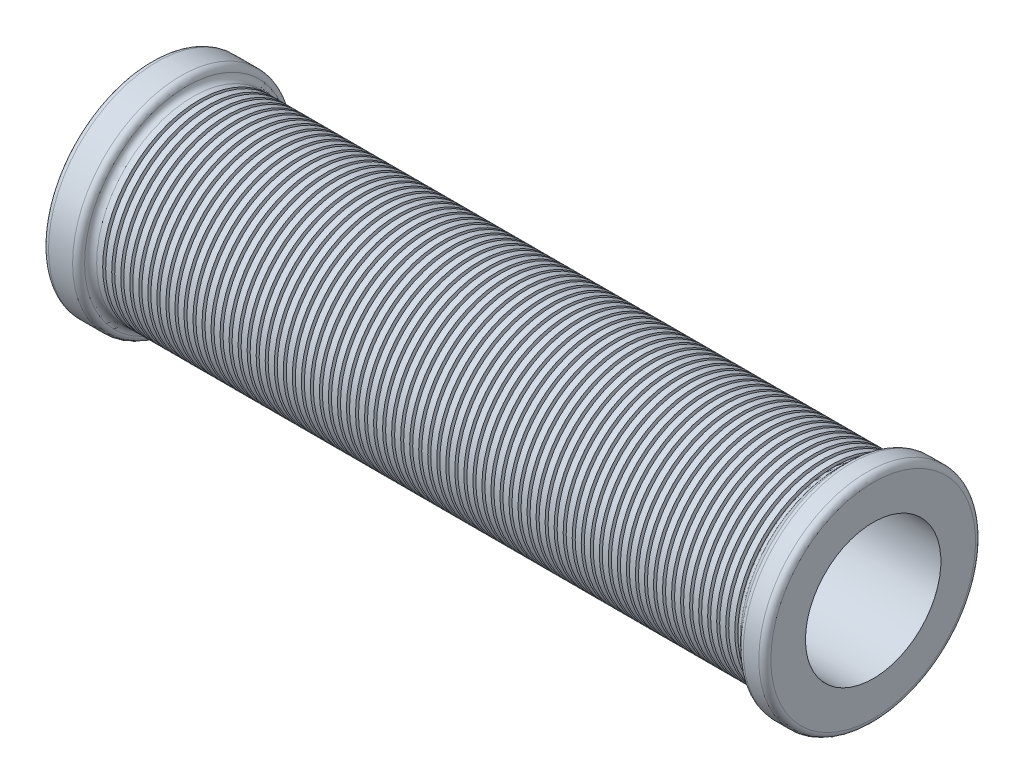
SolidWorks part; units mm, degrees
ref_plane "Alzado" through (0, 0, 0) normal (0, 0, 1) x (1, 0, 0)
ref_plane "Planta" through (0, 0, 0) normal (0, 1, 0) x (1, 0, 0)
ref_plane "Vista lateral" through (0, 0, 0) normal (1, 0, 0) x (0, 0, -1)
sketch "Croquis1" plane through (0, 0, 0) normal (0, 0, 1) x (1, 0, 0)
  line L0 (0, 0) -> (120, 0) construction
  line L1 (0, 0) -> (0, 11.25) construction
  line L2 (0, 18) -> (6, 18)
  line L3 (120, 11.25) -> (120, 0) construction
  line L4 (0, 11.25) -> (120, 11.25)
  line L5 (0, 11.25) -> (0, 18)
  line L7 (120, 11.25) -> (120, 18)
  line L8 (6, 18) -> (6, 16)
  line L9 (6, 16) -> (116, 16)
  line L10 (116, 16) -> (116, 18)
  line L11 (116, 18) -> (120, 18)
  point P12 (118, 18)
  dimension "D1" = 18
  dimension "D2" = 2
  dimension "D3" = 120
  dimension "D4" = 6
  dimension "D5" = 4
  dimension "D6" = 11.25
revolve "Revolución1" add sketch "Croquis1" angle 360 about L0
chamfer "Chaflán1" distance 2 angle 45 1 edges at (116, 0, 16)
fillet "Redondeo1" radius 1 6 edges at (120, 0, 18) (116, 0, 18) (114, 0, -16) (6, 0, 16) (6, 0, 18) (0, 0, 18)
sketch "Croquis2" plane through (0, 0, 0) normal (0, 0, 1) x (1, 0, 0)
  line L0 (113.5858, 16) -> (7, 16) construction
  line L1 (8, 16) -> (8.5, 16)
  line L2 (8, 16) -> (8, 15)
  line L3 (8, 15) -> (8.5, 15)
  line L4 (8.5, 16) -> (8.5, 15)
  line L5 (7, -16) -> (7, 16) construction
  line L6 (0, 0) -> (119, 0) construction
  line L7 (119, 18) -> (119, -18) construction
  line L372 (9.5, 16) -> (10, 16)
  line L373 (10, 16) -> (10, 15)
  line L374 (9.5, 15) -> (10, 15)
  line L375 (9.5, 16) -> (9.5, 15)
  line L376 (1.5, 0) -> (120.5, 0) construction
  line L377 (11, 16) -> (11.5, 16)
  line L378 (11.5, 16) -> (11.5, 15)
  line L379 (11, 15) -> (11.5, 15)
  line L380 (11, 16) -> (11, 15)
  line L381 (3, 0) -> (122, 0) construction
  line L382 (12.5, 16) -> (13, 16)
  line L383 (13, 16) -> (13, 15)
  line L384 (12.5, 15) -> (13, 15)
  line L385 (12.5, 16) -> (12.5, 15)
  line L386 (4.5, 0) -> (123.5, 0) construction
  line L387 (14, 16) -> (14.5, 16)
  line L388 (14.5, 16) -> (14.5, 15)
  line L389 (14, 15) -> (14.5, 15)
  line L390 (14, 16) -> (14, 15)
  line L391 (6, 0) -> (125, 0) construction
  line L392 (15.5, 16) -> (16, 16)
  line L393 (16, 16) -> (16, 15)
  line L394 (15.5, 15) -> (16, 15)
  line L395 (15.5, 16) -> (15.5, 15)
  line L396 (7.5, 0) -> (126.5, 0) construction
  line L397 (17, 16) -> (17.5, 16)
  line L398 (17.5, 16) -> (17.5, 15)
  line L399 (17, 15) -> (17.5, 15)
  line L400 (17, 16) -> (17, 15)
  line L401 (9, 0) -> (128, 0) construction
  line L402 (18.5, 16) -> (19, 16)
  line L403 (19, 16) -> (19, 15)
  line L404 (18.5, 15) -> (19, 15)
  line L405 (18.5, 16) -> (18.5, 15)
  line L406 (10.5, 0) -> (129.5, 0) construction
  line L407 (20, 16) -> (20.5, 16)
  line L408 (20.5, 16) -> (20.5, 15)
  line L409 (20, 15) -> (20.5, 15)
  line L410 (20, 16) -> (20, 15)
  line L411 (12, 0) -> (131, 0) construction
  line L412 (21.5, 16) -> (22, 16)
  line L413 (22, 16) -> (22, 15)
  line L414 (21.5, 15) -> (22, 15)
  line L415 (21.5, 16) -> (21.5, 15)
  line L416 (13.5, 0) -> (132.5, 0) construction
  line L417 (23, 16) -> (23.5, 16)
  line L418 (23.5, 16) -> (23.5, 15)
  line L419 (23, 15) -> (23.5, 15)
  line L420 (23, 16) -> (23, 15)
  line L421 (15, 0) -> (134, 0) construction
  line L422 (24.5, 16) -> (25, 16)
  line L423 (25, 16) -> (25, 15)
  line L424 (24.5, 15) -> (25, 15)
  line L425 (24.5, 16) -> (24.5, 15)
  line L426 (16.5, 0) -> (135.5, 0) construction
  line L427 (26, 16) -> (26.5, 16)
  line L428 (26.5, 16) -> (26.5, 15)
  line L429 (26, 15) -> (26.5, 15)
  line L430 (26, 16) -> (26, 15)
  line L431 (18, 0) -> (137, 0) construction
  line L432 (27.5, 16) -> (28, 16)
  line L433 (28, 16) -> (28, 15)
  line L434 (27.5, 15) -> (28, 15)
  line L435 (27.5, 16) -> (27.5, 15)
  line L436 (19.5, 0) -> (138.5, 0) construction
  line L437 (29, 16) -> (29.5, 16)
  line L438 (29.5, 16) -> (29.5, 15)
  line L439 (29, 15) -> (29.5, 15)
  line L440 (29, 16) -> (29, 15)
  line L441 (21, 0) -> (140, 0) construction
  line L442 (30.5, 16) -> (31, 16)
  line L443 (31, 16) -> (31, 15)
  line L444 (30.5, 15) -> (31, 15)
  line L445 (30.5, 16) -> (30.5, 15)
  line L446 (22.5, 0) -> (141.5, 0) construction
  line L447 (32, 16) -> (32.5, 16)
  line L448 (32.5, 16) -> (32.5, 15)
  line L449 (32, 15) -> (32.5, 15)
  line L450 (32, 16) -> (32, 15)
  line L451 (24, 0) -> (143, 0) construction
  line L452 (33.5, 16) -> (34, 16)
  line L453 (34, 16) -> (34, 15)
  line L454 (33.5, 15) -> (34, 15)
  line L455 (33.5, 16) -> (33.5, 15)
  line L456 (25.5, 0) -> (144.5, 0) construction
  line L457 (35, 16) -> (35.5, 16)
  line L458 (35.5, 16) -> (35.5, 15)
  line L459 (35, 15) -> (35.5, 15)
  line L460 (35, 16) -> (35, 15)
  line L461 (27, 0) -> (146, 0) construction
  line L462 (36.5, 16) -> (37, 16)
  line L463 (37, 16) -> (37, 15)
  line L464 (36.5, 15) -> (37, 15)
  line L465 (36.5, 16) -> (36.5, 15)
  line L466 (28.5, 0) -> (147.5, 0) construction
  line L467 (38, 16) -> (38.5, 16)
  line L468 (38.5, 16) -> (38.5, 15)
  line L469 (38, 15) -> (38.5, 15)
  line L470 (38, 16) -> (38, 15)
  line L471 (30, 0) -> (149, 0) construction
  line L472 (39.5, 16) -> (40, 16)
  line L473 (40, 16) -> (40, 15)
  line L474 (39.5, 15) -> (40, 15)
  line L475 (39.5, 16) -> (39.5, 15)
  line L476 (31.5, 0) -> (150.5, 0) construction
  line L477 (41, 16) -> (41.5, 16)
  line L478 (41.5, 16) -> (41.5, 15)
  line L479 (41, 15) -> (41.5, 15)
  line L480 (41, 16) -> (41, 15)
  line L481 (33, 0) -> (152, 0) construction
  line L482 (42.5, 16) -> (43, 16)
  line L483 (43, 16) -> (43, 15)
  line L484 (42.5, 15) -> (43, 15)
  line L485 (42.5, 16) -> (42.5, 15)
  line L486 (34.5, 0) -> (153.5, 0) construction
  line L487 (44, 16) -> (44.5, 16)
  line L488 (44.5, 16) -> (44.5, 15)
  line L489 (44, 15) -> (44.5, 15)
  line L490 (44, 16) -> (44, 15)
  line L491 (36, 0) -> (155, 0) construction
  line L492 (45.5, 16) -> (46, 16)
  line L493 (46, 16) -> (46, 15)
  line L494 (45.5, 15) -> (46, 15)
  line L495 (45.5, 16) -> (45.5, 15)
  line L496 (37.5, 0) -> (156.5, 0) construction
  line L497 (47, 16) -> (47.5, 16)
  line L498 (47.5, 16) -> (47.5, 15)
  line L499 (47, 15) -> (47.5, 15)
  line L500 (47, 16) -> (47, 15)
  line L501 (39, 0) -> (158, 0) construction
  line L502 (48.5, 16) -> (49, 16)
  line L503 (49, 16) -> (49, 15)
  line L504 (48.5, 15) -> (49, 15)
  line L505 (48.5, 16) -> (48.5, 15)
  line L506 (40.5, 0) -> (159.5, 0) construction
  line L507 (50, 16) -> (50.5, 16)
  line L508 (50.5, 16) -> (50.5, 15)
  line L509 (50, 15) -> (50.5, 15)
  line L510 (50, 16) -> (50, 15)
  line L511 (42, 0) -> (161, 0) construction
  line L512 (51.5, 16) -> (52, 16)
  line L513 (52, 16) -> (52, 15)
  line L514 (51.5, 15) -> (52, 15)
  line L515 (51.5, 16) -> (51.5, 15)
  line L516 (43.5, 0) -> (162.5, 0) construction
  line L517 (53, 16) -> (53.5, 16)
  line L518 (53.5, 16) -> (53.5, 15)
  line L519 (53, 15) -> (53.5, 15)
  line L520 (53, 16) -> (53, 15)
  line L521 (45, 0) -> (164, 0) construction
  line L522 (54.5, 16) -> (55, 16)
  line L523 (55, 16) -> (55, 15)
  line L524 (54.5, 15) -> (55, 15)
  line L525 (54.5, 16) -> (54.5, 15)
  line L526 (46.5, 0) -> (165.5, 0) construction
  line L527 (56, 16) -> (56.5, 16)
  line L528 (56.5, 16) -> (56.5, 15)
  line L529 (56, 15) -> (56.5, 15)
  line L530 (56, 16) -> (56, 15)
  line L531 (48, 0) -> (167, 0) construction
  line L532 (57.5, 16) -> (58, 16)
  line L533 (58, 16) -> (58, 15)
  line L534 (57.5, 15) -> (58, 15)
  line L535 (57.5, 16) -> (57.5, 15)
  line L536 (49.5, 0) -> (168.5, 0) construction
  line L537 (59, 16) -> (59.5, 16)
  line L538 (59.5, 16) -> (59.5, 15)
  line L539 (59, 15) -> (59.5, 15)
  line L540 (59, 16) -> (59, 15)
  line L541 (51, 0) -> (170, 0) construction
  line L542 (60.5, 16) -> (61, 16)
  line L543 (61, 16) -> (61, 15)
  line L544 (60.5, 15) -> (61, 15)
  line L545 (60.5, 16) -> (60.5, 15)
  line L546 (52.5, 0) -> (171.5, 0) construction
  line L547 (62, 16) -> (62.5, 16)
  line L548 (62.5, 16) -> (62.5, 15)
  line L549 (62, 15) -> (62.5, 15)
  line L550 (62, 16) -> (62, 15)
  line L551 (54, 0) -> (173, 0) construction
  line L552 (63.5, 16) -> (64, 16)
  line L553 (64, 16) -> (64, 15)
  line L554 (63.5, 15) -> (64, 15)
  line L555 (63.5, 16) -> (63.5, 15)
  line L556 (55.5, 0) -> (174.5, 0) construction
  line L557 (65, 16) -> (65.5, 16)
  line L558 (65.5, 16) -> (65.5, 15)
  line L559 (65, 15) -> (65.5, 15)
  line L560 (65, 16) -> (65, 15)
  line L561 (57, 0) -> (176, 0) construction
  line L562 (66.5, 16) -> (67, 16)
  line L563 (67, 16) -> (67, 15)
  line L564 (66.5, 15) -> (67, 15)
  line L565 (66.5, 16) -> (66.5, 15)
  line L566 (58.5, 0) -> (177.5, 0) construction
  line L567 (68, 16) -> (68.5, 16)
  line L568 (68.5, 16) -> (68.5, 15)
  line L569 (68, 15) -> (68.5, 15)
  line L570 (68, 16) -> (68, 15)
  line L571 (60, 0) -> (179, 0) construction
  line L572 (69.5, 16) -> (70, 16)
  line L573 (70, 16) -> (70, 15)
  line L574 (69.5, 15) -> (70, 15)
  line L575 (69.5, 16) -> (69.5, 15)
  line L576 (61.5, 0) -> (180.5, 0) construction
  line L577 (71, 16) -> (71.5, 16)
  line L578 (71.5, 16) -> (71.5, 15)
  line L579 (71, 15) -> (71.5, 15)
  line L580 (71, 16) -> (71, 15)
  line L581 (63, 0) -> (182, 0) construction
  line L582 (72.5, 16) -> (73, 16)
  line L583 (73, 16) -> (73, 15)
  line L584 (72.5, 15) -> (73, 15)
  line L585 (72.5, 16) -> (72.5, 15)
  line L586 (64.5, 0) -> (183.5, 0) construction
  line L587 (74, 16) -> (74.5, 16)
  line L588 (74.5, 16) -> (74.5, 15)
  line L589 (74, 15) -> (74.5, 15)
  line L590 (74, 16) -> (74, 15)
  line L591 (66, 0) -> (185, 0) construction
  line L592 (75.5, 16) -> (76, 16)
  line L593 (76, 16) -> (76, 15)
  line L594 (75.5, 15) -> (76, 15)
  line L595 (75.5, 16) -> (75.5, 15)
  line L596 (67.5, 0) -> (186.5, 0) construction
  line L597 (77, 16) -> (77.5, 16)
  line L598 (77.5, 16) -> (77.5, 15)
  line L599 (77, 15) -> (77.5, 15)
  line L600 (77, 16) -> (77, 15)
  line L601 (69, 0) -> (188, 0) construction
  line L602 (78.5, 16) -> (79, 16)
  line L603 (79, 16) -> (79, 15)
  line L604 (78.5, 15) -> (79, 15)
  line L605 (78.5, 16) -> (78.5, 15)
  line L606 (70.5, 0) -> (189.5, 0) construction
  line L607 (80, 16) -> (80.5, 16)
  line L608 (80.5, 16) -> (80.5, 15)
  line L609 (80, 15) -> (80.5, 15)
  line L610 (80, 16) -> (80, 15)
  line L611 (72, 0) -> (191, 0) construction
  line L612 (81.5, 16) -> (82, 16)
  line L613 (82, 16) -> (82, 15)
  line L614 (81.5, 15) -> (82, 15)
  line L615 (81.5, 16) -> (81.5, 15)
  line L616 (73.5, 0) -> (192.5, 0) construction
  line L617 (83, 16) -> (83.5, 16)
  line L618 (83.5, 16) -> (83.5, 15)
  line L619 (83, 15) -> (83.5, 15)
  line L620 (83, 16) -> (83, 15)
  line L621 (75, 0) -> (194, 0) construction
  line L622 (84.5, 16) -> (85, 16)
  line L623 (85, 16) -> (85, 15)
  line L624 (84.5, 15) -> (85, 15)
  line L625 (84.5, 16) -> (84.5, 15)
  line L626 (76.5, 0) -> (195.5, 0) construction
  line L627 (86, 16) -> (86.5, 16)
  line L628 (86.5, 16) -> (86.5, 15)
  line L629 (86, 15) -> (86.5, 15)
  line L630 (86, 16) -> (86, 15)
  line L631 (78, 0) -> (197, 0) construction
  line L632 (87.5, 16) -> (88, 16)
  line L633 (88, 16) -> (88, 15)
  line L634 (87.5, 15) -> (88, 15)
  line L635 (87.5, 16) -> (87.5, 15)
  line L636 (79.5, 0) -> (198.5, 0) construction
  line L637 (89, 16) -> (89.5, 16)
  line L638 (89.5, 16) -> (89.5, 15)
  line L639 (89, 15) -> (89.5, 15)
  line L640 (89, 16) -> (89, 15)
  line L641 (81, 0) -> (200, 0) construction
  line L642 (90.5, 16) -> (91, 16)
  line L643 (91, 16) -> (91, 15)
  line L644 (90.5, 15) -> (91, 15)
  line L645 (90.5, 16) -> (90.5, 15)
  line L646 (82.5, 0) -> (201.5, 0) construction
  line L647 (92, 16) -> (92.5, 16)
  line L648 (92.5, 16) -> (92.5, 15)
  line L649 (92, 15) -> (92.5, 15)
  line L650 (92, 16) -> (92, 15)
  line L651 (84, 0) -> (203, 0) construction
  line L652 (93.5, 16) -> (94, 16)
  line L653 (94, 16) -> (94, 15)
  line L654 (93.5, 15) -> (94, 15)
  line L655 (93.5, 16) -> (93.5, 15)
  line L656 (85.5, 0) -> (204.5, 0) construction
  line L657 (95, 16) -> (95.5, 16)
  line L658 (95.5, 16) -> (95.5, 15)
  line L659 (95, 15) -> (95.5, 15)
  line L660 (95, 16) -> (95, 15)
  line L661 (87, 0) -> (206, 0) construction
  line L662 (96.5, 16) -> (97, 16)
  line L663 (97, 16) -> (97, 15)
  line L664 (96.5, 15) -> (97, 15)
  line L665 (96.5, 16) -> (96.5, 15)
  line L666 (88.5, 0) -> (207.5, 0) construction
  line L667 (98, 16) -> (98.5, 16)
  line L668 (98.5, 16) -> (98.5, 15)
  line L669 (98, 15) -> (98.5, 15)
  line L670 (98, 16) -> (98, 15)
  line L671 (90, 0) -> (209, 0) construction
  line L672 (99.5, 16) -> (100, 16)
  line L673 (100, 16) -> (100, 15)
  line L674 (99.5, 15) -> (100, 15)
  line L675 (99.5, 16) -> (99.5, 15)
  line L676 (91.5, 0) -> (210.5, 0) construction
  line L677 (101, 16) -> (101.5, 16)
  line L678 (101.5, 16) -> (101.5, 15)
  line L679 (101, 15) -> (101.5, 15)
  line L680 (101, 16) -> (101, 15)
  line L681 (93, 0) -> (212, 0) construction
  line L682 (102.5, 16) -> (103, 16)
  line L683 (103, 16) -> (103, 15)
  line L684 (102.5, 15) -> (103, 15)
  line L685 (102.5, 16) -> (102.5, 15)
  line L686 (94.5, 0) -> (213.5, 0) construction
  line L687 (104, 16) -> (104.5, 16)
  line L688 (104.5, 16) -> (104.5, 15)
  line L689 (104, 15) -> (104.5, 15)
  line L690 (104, 16) -> (104, 15)
  line L691 (96, 0) -> (215, 0) construction
  line L692 (105.5, 16) -> (106, 16)
  line L693 (106, 16) -> (106, 15)
  line L694 (105.5, 15) -> (106, 15)
  line L695 (105.5, 16) -> (105.5, 15)
  line L696 (97.5, 0) -> (216.5, 0) construction
  line L697 (107, 16) -> (107.5, 16)
  line L698 (107.5, 16) -> (107.5, 15)
  line L699 (107, 15) -> (107.5, 15)
  line L700 (107, 16) -> (107, 15)
  line L701 (99, 0) -> (218, 0) construction
  line L702 (108.5, 16) -> (109, 16)
  line L703 (109, 16) -> (109, 15)
  line L704 (108.5, 15) -> (109, 15)
  line L705 (108.5, 16) -> (108.5, 15)
  line L706 (100.5, 0) -> (219.5, 0) construction
  line L707 (110, 16) -> (110.5, 16)
  line L708 (110.5, 16) -> (110.5, 15)
  line L709 (110, 15) -> (110.5, 15)
  line L710 (110, 16) -> (110, 15)
  line L711 (102, 0) -> (221, 0) construction
  line L712 (111.5, 16) -> (112, 16)
  line L713 (112, 16) -> (112, 15)
  line L714 (111.5, 15) -> (112, 15)
  line L715 (111.5, 16) -> (111.5, 15)
  line L716 (103.5, 0) -> (222.5, 0) construction
  line L717 (113, 16) -> (113.5, 16)
  line L718 (113.5, 16) -> (113.5, 15)
  line L719 (113, 15) -> (113.5, 15)
  line L720 (113, 16) -> (113, 15)
  line L721 (105, 0) -> (224, 0) construction
  dimension "D1" = 0.5
  dimension "D2" = 1
  dimension "D3" = 1
revolve "Cortar-Revolución1" cut sketch "Croquis2" angle 360 about L6
